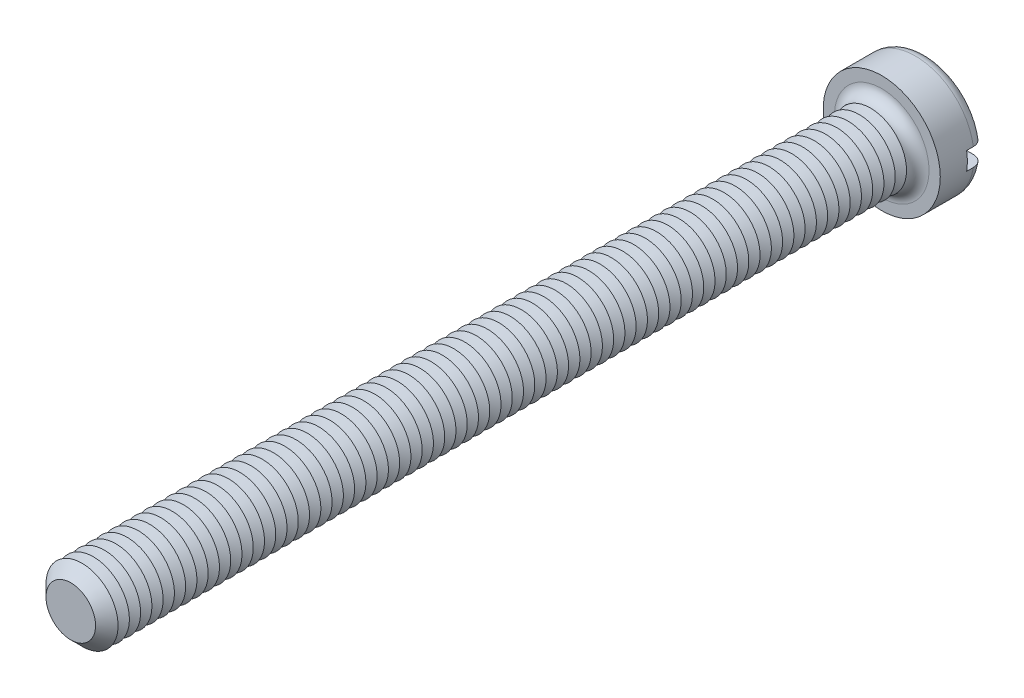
SolidWorks part; units mm, degrees
ref_plane "Front Plane" through (0, 0, 0) normal (0, 0, 1) x (1, 0, 0)
ref_plane "Top Plane" through (0, 0, 0) normal (0, 1, 0) x (1, 0, 0)
ref_plane "Right Plane" through (0, 0, 0) normal (1, 0, 0) x (0, 0, -1)
sketch "Sketch3" plane through (0, 0, 0) normal (0, 0, 1) x (1, 0, 0)
  circle A0 centre (0, 0) radius 6.5
  dimension "D1" = 13
extrude "Boss-Extrude2" add sketch "Sketch3" against normal blind 5
sketch "Sketch4" plane through (0, 0, 0) normal (0, 0, 1) x (1, 0, 0)
  circle A0 centre (0, 0) radius 4
  dimension "D1" = 8
extrude "Boss-Extrude3" add sketch "Sketch4" along normal blind 90
fillet "Fillet1" radius 1.25 2 edges at (6.5, 0, -5) (4, 0, 0)
chamfer "Chamfer1" distance 1.25 angle 45 1 edges at (4, 0, 90)
sketch "Sketch5" plane through (0, 0, 0) normal (1, 0, 0) x (0, 0, -1)
  line L0 (1.6944, 0) -> (-7.6738, 0) construction
sketch "Sketch6" plane through (0, 0, 0) normal (1, 0, 0) x (0, 0, -1)
  line L0 (-1.25, 4) -> (-1.875, 2.9175)
  line L1 (-1.875, 2.9175) -> (-2.5, 4)
  line L2 (-1.25, 4) -> (-88.75, 4) construction
  line L3 (-2.5, 4) -> (-1.25, 4)
  dimension "D1" = 1.25
revolve "Cut-Revolve1" cut sketch "Sketch6" angle 360 about L0
pattern_linear "LPattern1" count 70 spacing 1.25 along (0, 0, 1) of "Cut-Revolve1"
sketch "Sketch8" plane through (0, 0, -5) normal (0, 0, -1) x (-1, 0, 0)
  line L1 (6.5, -1) -> (-6.5, -1)
  line L2 (6.5, -1) -> (6.5, 1)
  line L3 (6.5, 1) -> (-6.5, 1)
  line L4 (-6.5, -1) -> (-6.5, 1)
  line L5 (6.5, -1) -> (-6.5, 1) construction
  line L6 (6.5, 1) -> (-6.5, -1) construction
  point P0 (0, 0)
  dimension "D1" = 13
  dimension "D2" = 2
extrude "Cut-Extrude1" cut sketch "Sketch8" against normal blind 2
